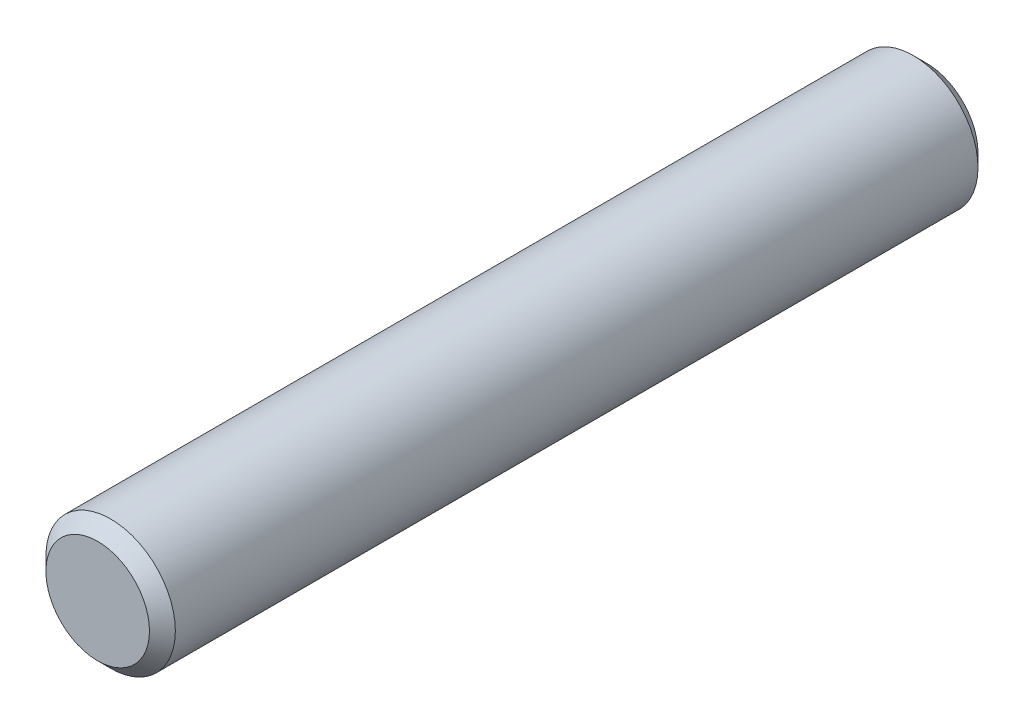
SolidWorks part; units mm, degrees
ref_plane "Face" through (0, 0, 0) normal (0, 0, 1) x (1, 0, 0)
ref_plane "Dessus" through (0, 0, 0) normal (0, 1, 0) x (1, 0, 0)
ref_plane "Droite" through (0, 0, 0) normal (1, 0, 0) x (0, 0, -1)
sketch "Esquisse1" plane through (0, 0, 0) normal (0, 0, 1) x (1, 0, 0)
  circle A0 centre (0, 0) radius 0.5
  dimension "D1" = 1
extrude "Extrusion1" add sketch "Esquisse1" along normal blind 6.4
chamfer "Chanfrein1" distance 0.1 angle 45 2 edges at (0.5, 0, 0) (0.5, 0, 6.4)
